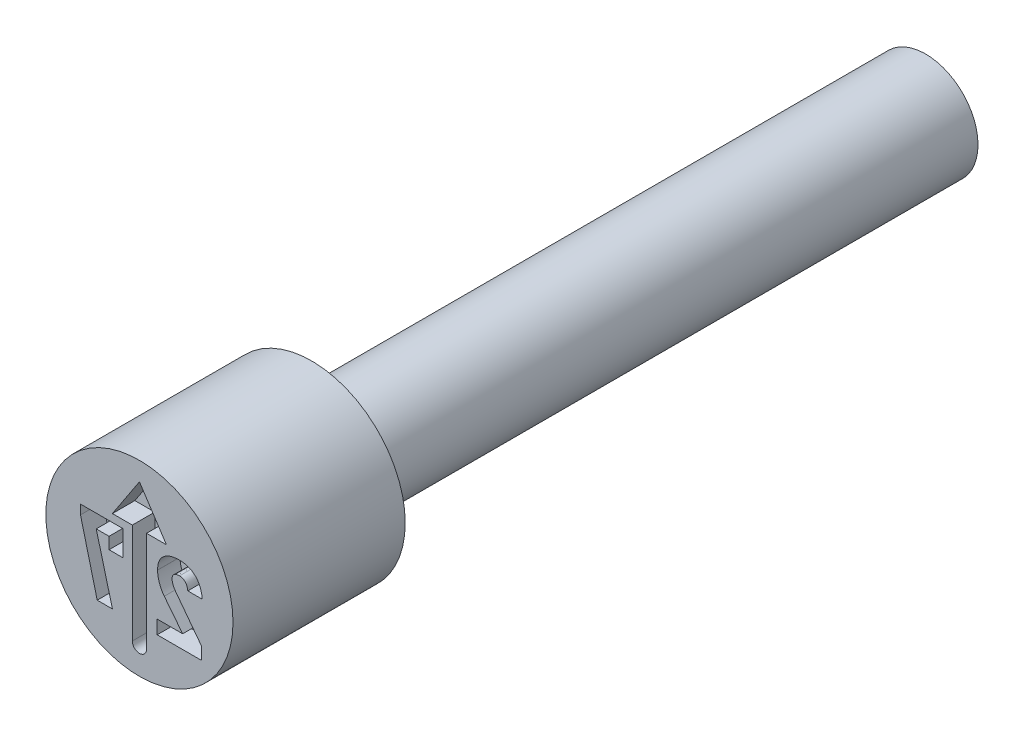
SolidWorks part; units mm, degrees
ref_plane "Front Plane" through (0, 0, 0) normal (0, 0, 1) x (1, 0, 0)
ref_plane "Top Plane" through (0, 0, 0) normal (0, 1, 0) x (1, 0, 0)
ref_plane "Right Plane" through (0, 0, 0) normal (1, 0, 0) x (0, 0, -1)
sketch "Sketch2" plane through (0, 0, 0) normal (1, 0, 0) x (0, 0, -1)
  line L0 (0.4039, 0) -> (50000.4039, 0) construction
  line L6 (0, 1.25) -> (0, 0)
  line L7 (2.3, 1.25) -> (0, 1.25)
  line L8 (2.3, 0.7) -> (2.3, 1.25)
  line L9 (10.5, 0.7) -> (2.3, 0.7)
  line L10 (10.5, 0) -> (10.5, 0.7)
  line L11 (0, 0) -> (10.5, 0)
  dimension "D1" = 2.5
  dimension "D2" = 1.4
  dimension "D3" = 10.5
  dimension "D4" = 2.3
revolve "Revolve1" add sketch "Sketch2" angle 360 about L0
sketch "Sketch3" plane through (0, 0, 0) normal (0, 0, 1) x (1, 0, 0)
  line L0 (0, 0) -> (0, 50000) construction
  line L1 (0.0952, 0.4532) -> (0.0952, -0.8881)
  line L2 (0.361, 0.4532) -> (0.0952, 0.4532)
  line L3 (0, 1.0011) -> (0.361, 0.4532)
  line L15 (0, 1.0011) -> (-0.361, 0.4532)
  line L16 (-0.361, 0.4532) -> (-0.0952, 0.4532)
  line L17 (-0.0952, 0.4532) -> (-0.0952, -0.8881)
  arc A2 (-0.0952, -0.8881) -> (0.0952, -0.8881) centre (0, -0.8881) ccw
extrude "Cut-Extrude4" cut sketch "Sketch3" against normal blind 0.3
sketch "Sketch4" plane through (0, 0, 0) normal (0, 0, 1) x (1, 0, 0)
  text T0 "2 7" font "Bahnschrift" height 1
  dimension "D1" = 0.65
  dimension "D2" = 0.9
extrude "Cut-Extrude5" cut sketch "Sketch4" against normal blind 0.3
